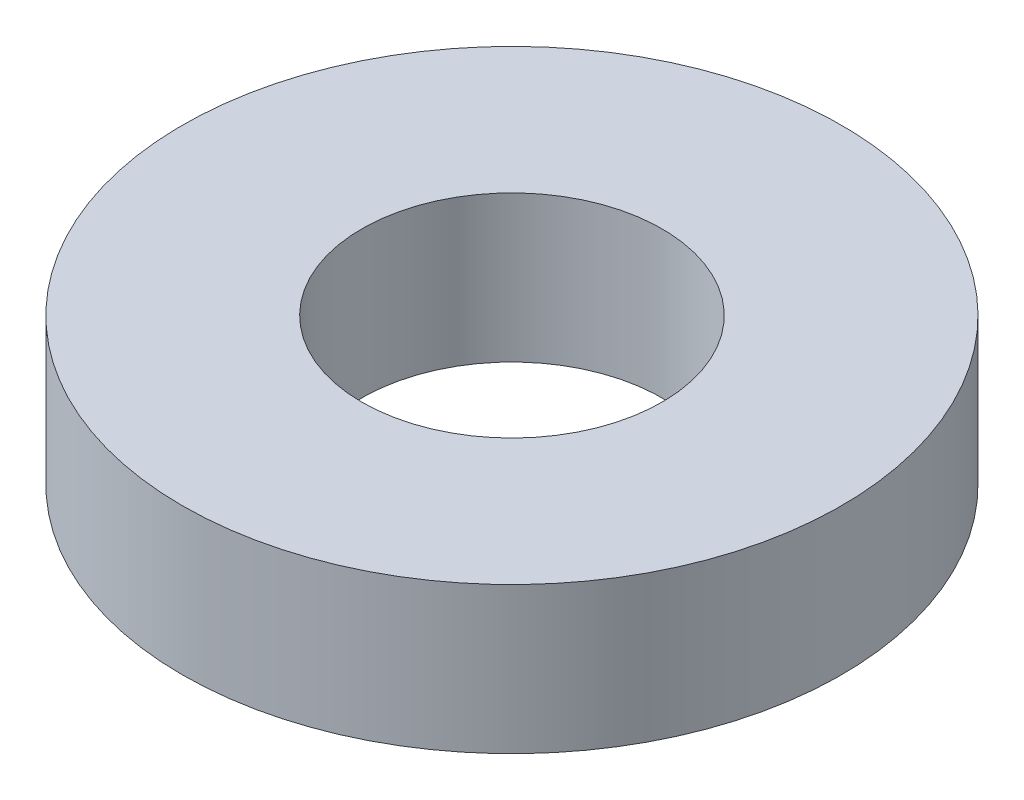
SolidWorks part; units mm, degrees
ref_plane "Plan de face" through (0, 0, 0) normal (0, 0, 1) x (1, 0, 0)
ref_plane "Plan de dessus" through (0, 0, 0) normal (0, 1, 0) x (1, 0, 0)
ref_plane "Plan de droite" through (0, 0, 0) normal (1, 0, 0) x (0, 0, -1)
sketch "Esquisse1" plane through (0, 0, 0) normal (0, 1, 0) x (1, 0, 0)
  circle A0 centre (0, 0) radius 9
  circle A1 centre (0, 0) radius 4.1
extrude "Extrusion1" add sketch "Esquisse1" along normal blind 4
